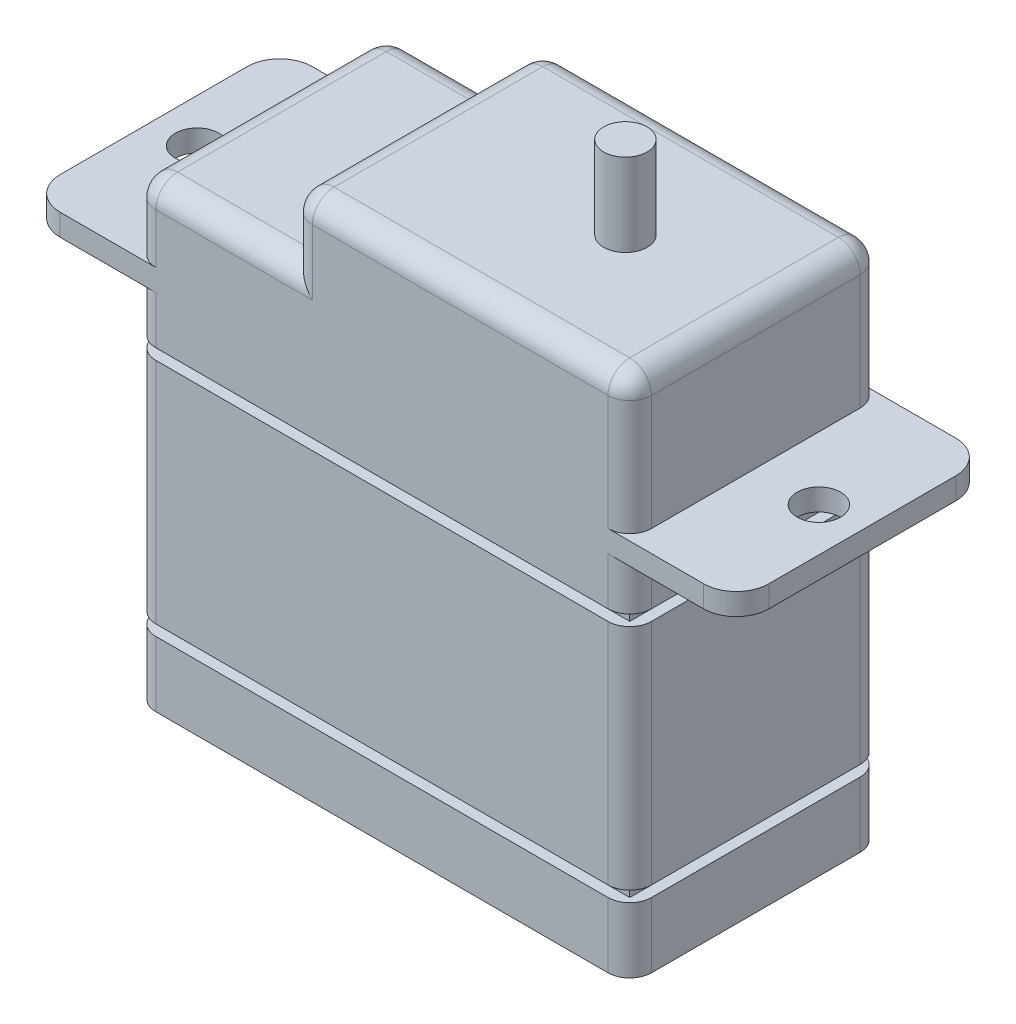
SolidWorks part; units mm, degrees
ref_plane "Vorne" through (0, 0, 0) normal (0, 0, 1) x (1, 0, 0)
ref_plane "Oben" through (0, 0, 0) normal (0, 1, 0) x (1, 0, 0)
ref_plane "Rechts" through (0, 0, 0) normal (1, 0, 0) x (0, 0, -1)
sketch "Skizze1" plane through (0, 0, 0) normal (0, 0, 1) x (1, 0, 0)
  line L0 (0, 21) -> (7.2, 21)
  line L1 (0, 0) -> (22.8, 0)
  line L2 (0, 0) -> (0, 21)
  line L3 (7.2, 24) -> (22.8, 24)
  line L4 (22.8, 0) -> (22.8, 24)
  line L5 (7.2, 21) -> (7.2, 24)
  dimension "D1" = 22.8
  dimension "D2" = 7.2
  dimension "D3" = 3
  dimension "D4" = 24
extrude "Linear austragen1" add sketch "Skizze1" along normal blind 11.6
ref_plane "Ebene1" through (0, 3, 0) normal (0, -1, 0) x (1, 0, 0)
sketch "Skizze4" plane through (0, 3, 0) normal (0, -1, 0) x (1, 0, 0)
  line L8 (0.5, 0.5) -> (22.3, 0.5)
  line L9 (22.3, 0.5) -> (22.3, 11.1)
  line L10 (22.3, 11.1) -> (0.5, 11.1)
  line L11 (0.5, 11.1) -> (0.5, 0.5)
  line L12 (0.5, 0.5) -> (22.3, 0.5)
  line L13 (22.3, 0.5) -> (22.3, 11.1)
  line L14 (22.3, 11.1) -> (0.5, 11.1)
  line L15 (0.5, 11.1) -> (0.5, 0.5)
  dimension "D1" = 0.5
extrude "Schnitt-Linear austragen2" cut sketch "Skizze4" against normal blind 0.5 flip side to cut
ref_plane "Ebene2" through (0, 14, 0) normal (0, -1, 0) x (1, 0, 0)
sketch "Skizze5" plane through (0, 14, 0) normal (0, -1, 0) x (1, 0, 0)
  line L4 (0.5, 0.5) -> (22.3, 0.5)
  line L5 (22.3, 0.5) -> (22.3, 11.1)
  line L6 (22.3, 11.1) -> (0.5, 11.1)
  line L7 (0.5, 11.1) -> (0.5, 0.5)
  line L8 (0.5, 0.5) -> (22.3, 0.5)
  line L9 (22.3, 0.5) -> (22.3, 11.1)
  line L10 (22.3, 11.1) -> (0.5, 11.1)
  line L11 (0.5, 11.1) -> (0.5, 0.5)
  dimension "D1" = 0
extrude "Schnitt-Linear austragen3" cut sketch "Skizze5" against normal blind 0.5 flip side to cut
ref_plane "Ebene3" through (0, 16.7, 0) normal (0, -1, 0) x (1, 0, 0)
sketch "Skizze6" plane through (0, 16.7, 0) normal (0, -1, 0) x (1, 0, 0)
  line L0 (22.8, 11.6) -> (7.2, 11.6) construction
  line L1 (0, 11.6) -> (-3.4, 11.6)
  line L2 (0, 11.6) -> (0, 0)
  line L3 (0, 0) -> (-3.4, 0)
  line L4 (-4.9, 10.1) -> (-4.9, 1.5)
  line L5 (22.8, 0) -> (26.2, 0)
  line L6 (22.8, 0) -> (22.8, 11.6)
  line L7 (22.8, 11.6) -> (26.2, 11.6)
  line L8 (27.7, 1.5) -> (27.7, 10.1)
  line L9 (7.2, 0) -> (0, 0) construction
  line L10 (-992.8, 5.8) -> (49007.2, 5.8) construction
  line L11 (7.2, 11.6) -> (7.2, 0) construction
  line L12 (11.4, -998.2609) -> (11.4, 49001.7391) construction
  arc A0 (26.2, 0) -> (27.7, 1.5) centre (26.2, 1.5) ccw
  arc A1 (26.2, 11.6) -> (27.7, 10.1) centre (26.2, 10.1) cw
  arc A2 (-3.4, 11.6) -> (-4.9, 10.1) centre (-3.4, 10.1) ccw
  arc A3 (-3.4, 0) -> (-4.9, 1.5) centre (-3.4, 1.5) cw
  circle A4 centre (25.7, 5.8) radius 1
  circle A5 centre (-2.9, 5.8) radius 1
  point P18 (27.7, 11.6)
  point P23 (-4.9, 0)
  point P29 (7.2, 5.8)
  dimension "D3" = 1.5
  dimension "D5" = 2
  dimension "D1" = 32.6
  dimension "D2" = 28.6
  dimension "D4" = 16.3
extrude "Linear austragen2" add sketch "Skizze6" against normal blind 1
fillet "Verrundung2" radius 1 29 edges at (22.8, 1.5, 11.6) (7.2, 24, 5.8) (22.8, 24, 5.8) (15, 24, 11.6) (7.2, 22.5, 11.6) (0, 1.5, 0) (22.8, 8.75, 0) (3.6, 21, 11.6) (0, 1.5, 11.6) (22.8, 8.75, 11.6) (0, 8.75, 0) (0, 8.75, 11.6) (3.6, 21, 0) (7.2, 22.5, 0) (15, 24, 0) (22.8, 1.5, 0) (0, 21, 5.8)
sketch "Skizze7" plane through (0, 24, 0) normal (0, 1, 0) x (-1, 0, 0)
  line L0 (-1021.8, 5.8) -> (48978.2, 5.8) construction
  line L1 (-21.8, 10.6) -> (-21.8, 1) construction
  line L2 (-16.8, -995.0465) -> (-16.8, 49004.9535) construction
  line L3 (-22.8, 10.6) -> (-22.8, 1) construction
  circle A0 centre (-16.8, 5.8) radius 1
  point P5 (-21.8, 5.8)
  dimension "D2" = 2
  dimension "D1" = 6
extrude "Linear austragen3" add sketch "Skizze7" along normal offset from surface (3.8 mm away) 11.1
equation "\"D4@Skizze6\" = \"D1@Skizze6\"/2"
